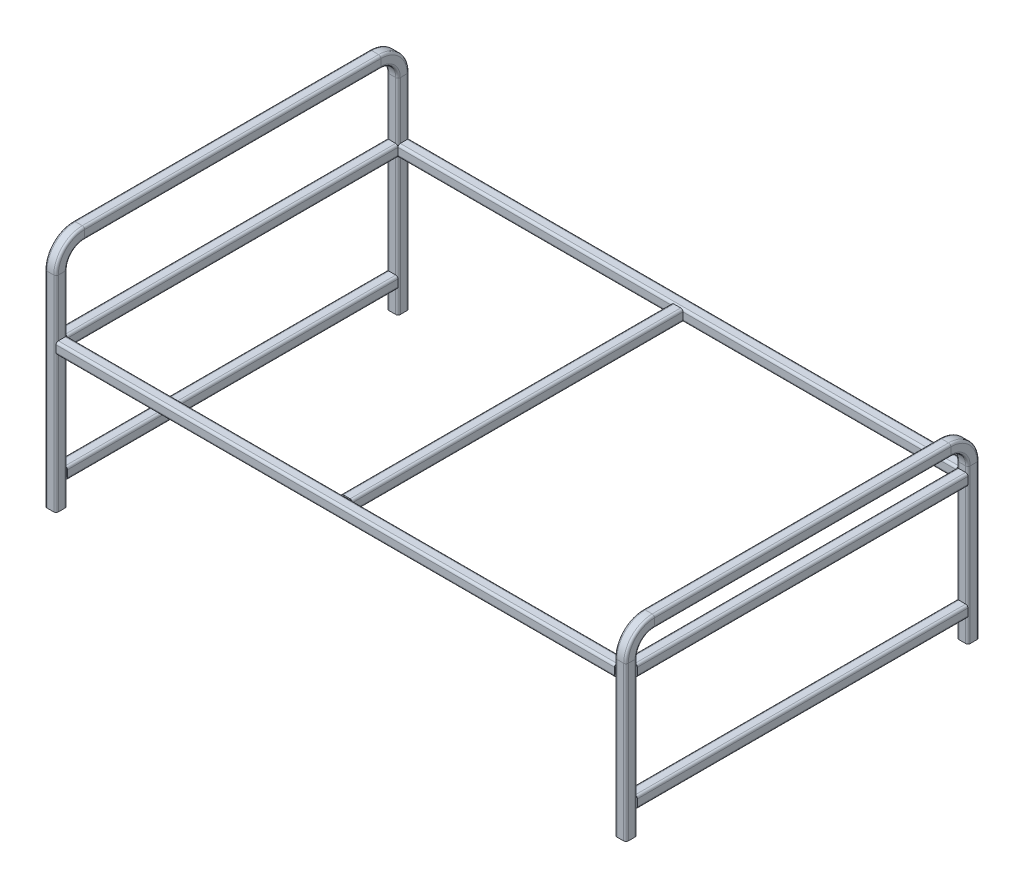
SolidWorks part; units mm, degrees
ref_plane "Front Plane" through (0, 0, 0) normal (0, 0, 1) x (1, 0, 0)
ref_plane "Top Plane" through (0, 0, 0) normal (0, 1, 0) x (1, 0, 0)
ref_plane "Right Plane" through (0, 0, 0) normal (1, 0, 0) x (0, 0, -1)
sketch "Sketch1" plane through (0, 0, 0) normal (1, 0, 0) x (0, 0, -1)
  line L0 (0, 0) -> (0, 800) construction
  line L1 (-600, 0) -> (-600, 720)
  line L2 (-520, 800) -> (520, 800)
  line L3 (600, 0) -> (600, 720)
  line L4 (-600, 500) -> (600, 500)
  line L5 (-600, 100) -> (600, 100)
  arc A0 (600, 720) -> (520, 800) centre (520, 720) ccw
  arc A1 (-520, 800) -> (-600, 720) centre (-520, 720) ccw
  point P10 (600, 800)
  point P13 (-600, 800)
  dimension "D3" = 80
  dimension "D1" = 800
  dimension "D2" = 1200
  dimension "D4" = 300
  dimension "D5" = 100
ref_plane "Plane1" through (2000, 0, 0) normal (1, 0, 0) x (0, 0, -1)
sketch "Sketch2" plane through (2000, 0, 0) normal (1, 0, 0) x (0, 0, -1)
  line L0 (-600, 0) -> (-600, 540)
  line L1 (-600, 0) -> (-600, 720) construction
  line L2 (-520, 620) -> (520, 620)
  line L3 (600, 0) -> (600, 720) construction
  line L4 (600, 540) -> (600, 0)
  line L5 (0, 0) -> (0, 620) construction
  line L6 (-600, 500) -> (600, 500)
  line L8 (-600, 100) -> (600, 100)
  arc A0 (600, 540) -> (520, 620) centre (520, 540) ccw
  arc A1 (-520, 620) -> (-600, 540) centre (-520, 540) ccw
  point P15 (600, 620)
  point P18 (-600, 620)
  dimension "D2" = 80
  dimension "D1" = 620
sketch3d "3DSketch1"
  line L0 (1000, 500, -600) -> (1000, 500, 600)
  line L2 (2000, 500, -600) -> (0, 500, -600)
  line L3 (2000, 500, 600) -> (0, 500, 600)
other "Square tube 40 X 40 X 4(4)"
ref_plane "Plane7" through (0, 0, 600) normal (0, 1, 0) x (0, 0, 1)
sketch "Sketch16" plane through (0, 0, 600) normal (0, 1, 0) x (0, 0, 1)
  line L0 (-12, -16) -> (12, -16)
  line L1 (-16, -12) -> (-16, 12)
  line L2 (12, 16) -> (-12, 16)
  line L3 (16, 12) -> (16, -12)
  line L4 (-12, -20) -> (12, -20)
  line L5 (-20, -12) -> (-20, 12)
  line L6 (12, 20) -> (-12, 20)
  line L7 (20, 12) -> (20, -12)
  arc A0 (20, 12) -> (12, 20) centre (12, 12) ccw
  arc A1 (12, -20) -> (20, -12) centre (12, -12) ccw
  arc A2 (-20, -12) -> (-12, -20) centre (-12, -12) ccw
  arc A3 (-12, 20) -> (-20, 12) centre (-12, 12) ccw
  arc A4 (-12, 16) -> (-16, 12) centre (-12, 12) ccw
  arc A5 (16, 12) -> (12, 16) centre (12, 12) ccw
  arc A6 (12, -16) -> (16, -12) centre (12, -12) ccw
  arc A7 (-16, -12) -> (-12, -16) centre (-12, -12) ccw
  point P0 (-20, 0)
  point P1 (20, 0)
  point P2 (0, 20)
  point P3 (0, -20)
  point P4 (0, 0)
  point P5 (-20, -20)
  point P6 (20, -20)
  point P7 (20, 20)
  point P8 (-20, 20)
  point P33 (0, 0)
  dimension "D1" = 8
  dimension "Thickness" = 4
  dimension "V_leg" = 40
other "Square tube 40 X 40 X 4(5)"
ref_plane "Plane8" through (2000, 0, 600) normal (0, 1, 0) x (0, 0, 1)
sketch "Sketch17" plane through (2000, 0, 600) normal (0, 1, 0) x (0, 0, 1)
  line L0 (-12, -16) -> (12, -16)
  line L1 (-16, -12) -> (-16, 12)
  line L2 (12, 16) -> (-12, 16)
  line L3 (16, 12) -> (16, -12)
  line L4 (-12, -20) -> (12, -20)
  line L5 (-20, -12) -> (-20, 12)
  line L6 (12, 20) -> (-12, 20)
  line L7 (20, 12) -> (20, -12)
  arc A0 (20, 12) -> (12, 20) centre (12, 12) ccw
  arc A1 (12, -20) -> (20, -12) centre (12, -12) ccw
  arc A2 (-20, -12) -> (-12, -20) centre (-12, -12) ccw
  arc A3 (-12, 20) -> (-20, 12) centre (-12, 12) ccw
  arc A4 (-12, 16) -> (-16, 12) centre (-12, 12) ccw
  arc A5 (16, 12) -> (12, 16) centre (12, 12) ccw
  arc A6 (12, -16) -> (16, -12) centre (12, -12) ccw
  arc A7 (-16, -12) -> (-12, -16) centre (-12, -12) ccw
  point P0 (-20, 0)
  point P1 (20, 0)
  point P2 (0, 20)
  point P3 (0, -20)
  point P4 (0, 0)
  point P5 (-20, -20)
  point P6 (20, -20)
  point P7 (20, 20)
  point P8 (-20, 20)
  point P33 (0, 0)
  dimension "D1" = 8
  dimension "Thickness" = 4
  dimension "V_leg" = 40
other "Square tube 40 X 40 X 4(6)"
ref_plane "Plane9" through (2000, 500, 600) normal (-1, 0, 0) x (0, 0, 1)
sketch "Sketch18" plane through (2000, 500, 600) normal (-1, 0, 0) x (0, 0, 1)
  line L0 (-12, -16) -> (12, -16)
  line L1 (-16, -12) -> (-16, 12)
  line L2 (12, 16) -> (-12, 16)
  line L3 (16, 12) -> (16, -12)
  line L4 (-12, -20) -> (12, -20)
  line L5 (-20, -12) -> (-20, 12)
  line L6 (12, 20) -> (-12, 20)
  line L7 (20, 12) -> (20, -12)
  arc A0 (20, 12) -> (12, 20) centre (12, 12) ccw
  arc A1 (12, -20) -> (20, -12) centre (12, -12) ccw
  arc A2 (-20, -12) -> (-12, -20) centre (-12, -12) ccw
  arc A3 (-12, 20) -> (-20, 12) centre (-12, 12) ccw
  arc A4 (-12, 16) -> (-16, 12) centre (-12, 12) ccw
  arc A5 (16, 12) -> (12, 16) centre (12, 12) ccw
  arc A6 (12, -16) -> (16, -12) centre (12, -12) ccw
  arc A7 (-16, -12) -> (-12, -16) centre (-12, -12) ccw
  point P0 (-20, 0)
  point P1 (20, 0)
  point P2 (0, 20)
  point P3 (0, -20)
  point P4 (0, 0)
  point P5 (-20, -20)
  point P6 (20, -20)
  point P7 (20, 20)
  point P8 (-20, 20)
  point P33 (0, 0)
  dimension "D1" = 8
  dimension "Thickness" = 4
  dimension "V_leg" = 40
other "Trim/Extend2"
